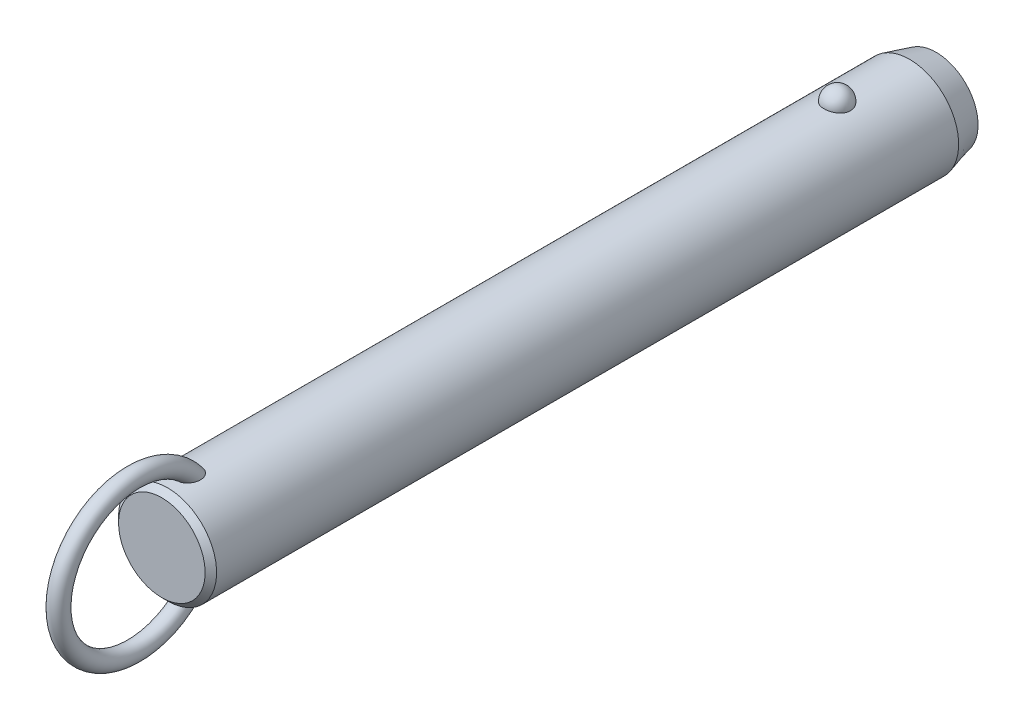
SolidWorks part; units mm, degrees
ref_plane "Front Plane" through (0, 0, 0) normal (0, 0, 1) x (1, 0, 0)
ref_plane "Top Plane" through (0, 0, 0) normal (0, 1, 0) x (1, 0, 0)
ref_plane "Right Plane" through (0, 0, 0) normal (1, 0, 0) x (0, 0, -1)
sketch "Sketch2" plane through (0, 0, 0) normal (0, 0, 1) x (1, 0, 0)
  circle A0 centre (0, 0) radius 11.1
  point P3 (0, 11.1)
  dimension "D1" = 22.2
extrude "Boss-Extrude1" add sketch "Sketch2" along normal blind 137.2
sketch "Sketch3" plane through (0, 0, 0) normal (0, 0, -1) x (-1, 0, 0)
  circle A0 centre (0, 0) radius 11.1
  dimension "D1" = 22.2
extrude "Boss-Extrude2" add sketch "Sketch3" along normal blind 25.4
chamfer "Chamfer1" distance 6 angle 15 1 edges at (-11.1, 0, -25.4)
sketch "Sketch12" plane through (0, 0, 0) normal (1, 0, 0) x (0, 0, -1)
  line L0 (-137.2, 11.1) -> (-137.2, -11.1) construction
  point P0 (-137.2, 0)
sketch "Sketch13" plane through (0, 0, 0) normal (1, 0, 0) x (0, 0, -1)
  circle A0 centre (-156.25, 0) radius 19.05
  point P2 (-137.2, 0)
  dimension "D1" = 38.1
sketch "Sketch14" plane through (0, 0, 0) normal (0, 1, 0) x (1, 0, 0)
  circle A0 centre (0, -139.2) radius 2
  point P2 (0, -137.2)
  dimension "D1" = 4
sweep "Sweep1" add profiles "Sketch14" path "Sketch13"
sketch "Sketch15" plane through (0, 0, 137.2) normal (0, 0, 1) x (1, 0, 0)
  circle A0 centre (0, 0) radius 11.1
  dimension "D1" = 22.2
extrude "Boss-Extrude3" add sketch "Sketch15" along normal blind 12.7
chamfer "Chamfer2" distance 1.3 angle 45 1 edges at (11.1, 0, 149.9)
sketch "Sketch18" plane through (0, 0, 0) normal (1, 0, 0) x (0, 0, -1)
  line L0 (19.4, 11.1) -> (-140.768, 11.1) construction
  line L1 (3, 14.1) -> (3, 8.1)
  line L2 (-140.768, -11.1) -> (19.4, -11.1) construction
  arc A0 (3, 14.1) -> (3, 8.1) centre (3, 11.1) ccw
  point P4 (0, 11.1)
  dimension "D1" = 25.2
revolve "Revolve1" add sketch "Sketch18" angle 360 about L1
